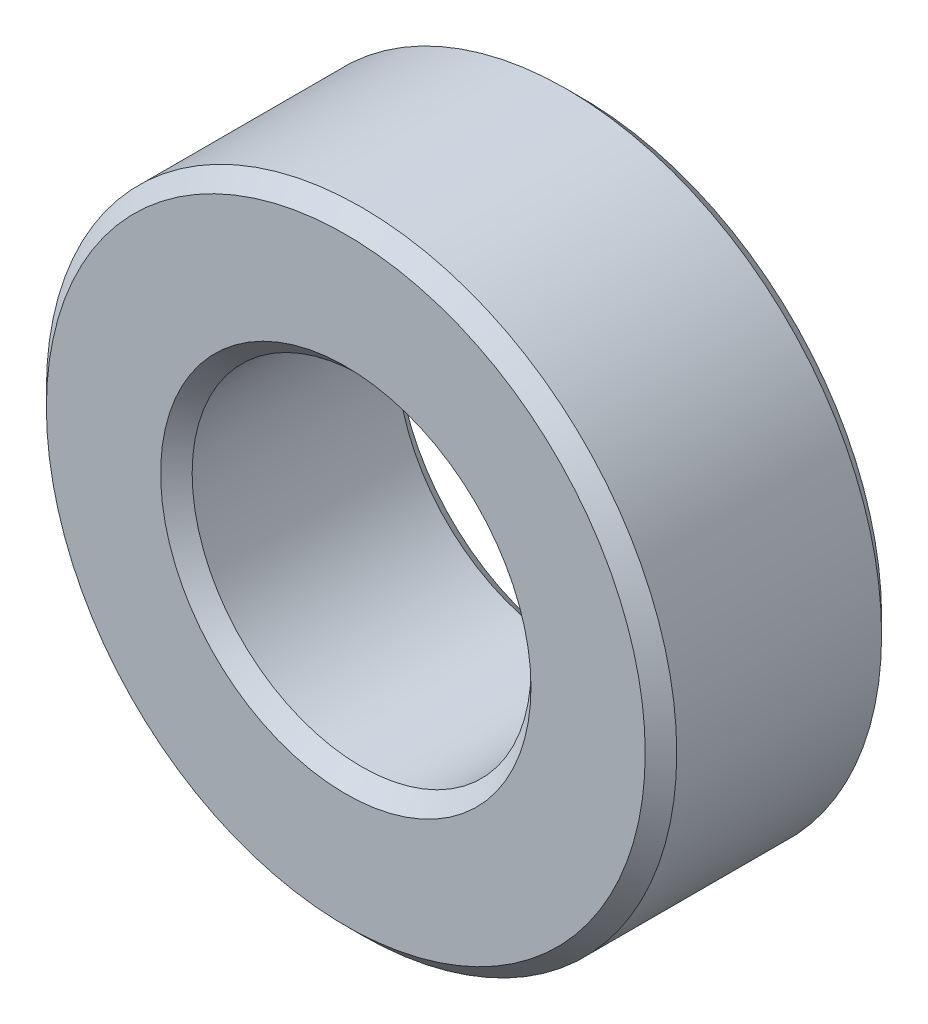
SolidWorks part; units mm, degrees
ref_plane "Front Plane" through (0, 0, 0) normal (0, 0, 1) x (1, 0, 0)
ref_plane "Top Plane" through (0, 0, 0) normal (0, 1, 0) x (1, 0, 0)
ref_plane "Right Plane" through (0, 0, 0) normal (1, 0, 0) x (0, 0, -1)
sketch "Sketch1" plane through (0, 0, 0) normal (0, 0, 1) x (1, 0, 0)
  circle A0 centre (0, 0) radius 4
  circle A1 centre (0, 0) radius 2.15
  dimension "D1" = 8
  dimension "D2" = 4.3
extrude "Boss-Extrude2" add sketch "Sketch1" along normal mid plane 3
chamfer "Chamfer3" distance 0.2 angle 45 4 edges at (4, 0, 1.5) (4, 0, -1.5) (2.15, 0, -1.5) (2.15, 0, 1.5)
